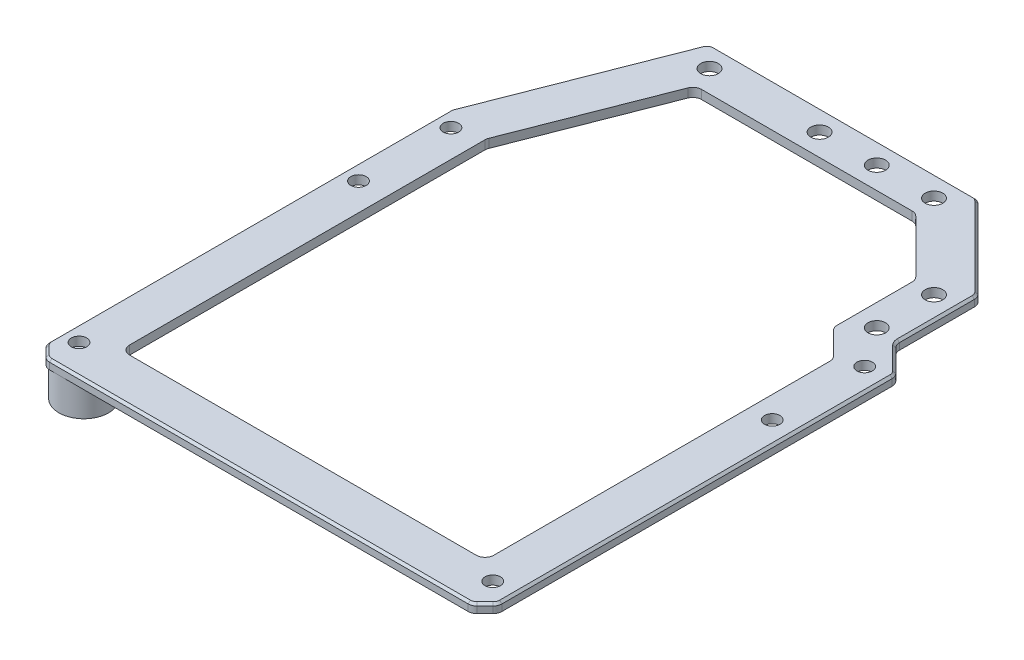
SolidWorks part; units mm, degrees
ref_plane "Спереди" through (0, 0, 0) normal (0, 0, 1) x (1, 0, 0)
ref_plane "Сверху" through (0, 0, 0) normal (0, 1, 0) x (1, 0, 0)
ref_plane "Справа" through (0, 0, 0) normal (1, 0, 0) x (0, 0, -1)
sketch "Эскиз1" plane through (0, 0, 0) normal (0, 1, 0) x (1, 0, 0)
  line L1 (-54, 0) -> (54, 0)
  line L2 (-54, 0) -> (-54, 92)
  line L3 (-54, 92) -> (54, 92)
  line L4 (54, 0) -> (54, 92)
  circle A0 centre (-50.25, 88.25) radius 1.75
  circle A1 centre (-50.25, 67.25) radius 1.75
  circle A2 centre (-50.25, 3.75) radius 1.75
  circle A3 centre (43.75, 3.75) radius 1.75
  circle A4 centre (43.75, 67.25) radius 1.75
  circle A5 centre (43.75, 88.25) radius 1.75
  point P0 (0, 0)
  dimension "D1" = 3.5
  dimension "D2" = 24.75
  dimension "D3" = 3.75
  dimension "D4" = 3.75
  dimension "D5" = 84.5
  dimension "D6" = 3.75
  dimension "D7" = 94
  dimension "D8" = 10.25
extrude "Бобышка-Вытянуть1" add sketch "Эскиз1" along normal blind 2
sketch "Эскиз2" plane through (0, 0, 0) normal (0, 1, 0) x (1, 0, 0)
  line L0 (37.5, 58.6841) -> (37.5, 145.1894) construction
  line L1 (37.5, 129.25) -> (14.1487, 129.25) construction
  line L2 (23.5, 134.25) -> (-37.5, 134.25)
  line L3 (-37.5, 134.25) -> (-54, 92)
  line L4 (-54, 92) -> (-54, 0)
  line L5 (-54, 0) -> (-51, -3)
  line L6 (-51, -3) -> (45.75, -3)
  line L7 (45.75, -3) -> (48.75, 0)
  line L8 (48.75, 0) -> (48.75, 90.3211)
  line L9 (48.75, 90.3211) -> (42.5, 96.5711)
  line L10 (42.5, 96.5711) -> (42.5, 115.25)
  line L11 (42.5, 115.25) -> (23.5, 134.25)
  line L12 (-32.5, 129.25) -> (-38.0503, 129.25) construction
  line L13 (-54, 0) -> (54, 0) construction
  line L14 (32.5, 111.1079) -> (19.3579, 124.25)
  line L15 (19.3579, 124.25) -> (-30.6698, 124.25)
  line L16 (-30.6698, 124.25) -> (-44, 90.1166)
  line L17 (-44, 90.1166) -> (-44, 7)
  line L18 (-44, 7) -> (-44, 7)
  line L19 (-44, 7) -> (38.75, 7)
  line L20 (38.75, 7) -> (38.75, 7)
  line L21 (38.75, 7) -> (38.75, 86.1789)
  line L22 (38.75, 86.1789) -> (32.5, 92.4289)
  line L23 (32.5, 92.4289) -> (32.5, 111.1079)
  circle A0 centre (43.75, 88.25) radius 1.75 construction
  circle A1 centre (37.5, 97.25) radius 2
  circle A2 centre (37.5, 110.25) radius 2
  circle A3 centre (18.5, 129.25) radius 2
  circle A4 centre (5.5, 129.25) radius 2
  circle A5 centre (-7.5, 129.25) radius 2
  circle A6 centre (-32.5, 129.25) radius 2
  circle A7 centre (43.75, 67.25) radius 1.75 construction
  circle A8 centre (43.75, 3.75) radius 1.75 construction
  circle A9 centre (-50.25, 3.75) radius 1.75 construction
  circle A10 centre (-50.25, 67.25) radius 1.75 construction
  circle A11 centre (-50.25, 88.25) radius 1.75 construction
  circle A12 centre (43.75, 88.25) radius 1.75
  circle A13 centre (43.75, 67.25) radius 1.75
  circle A14 centre (43.75, 3.75) radius 1.75
  circle A15 centre (-50.25, 3.75) radius 1.75
  circle A16 centre (-50.25, 67.25) radius 1.75
  circle A17 centre (-50.25, 88.25) radius 1.75
  point P32 (-37.5, 129.25)
  point P37 (23.5, 129.25)
  dimension "D1" = 6.25
  dimension "D2" = 4
  dimension "D3" = 9
  dimension "D9" = 25
  dimension "D13" = 5
  dimension "D14" = 5
  dimension "D4" = 13
  dimension "D5" = 19
  dimension "D6" = 19
  dimension "D7" = 13
  dimension "D8" = 13
  dimension "D10" = 5
  dimension "D11" = 135
  dimension "D12" = 5
  dimension "D15" = 135
  dimension "D16" = 135
  dimension "D17" = 5
  dimension "D18" = 3
  dimension "D19" = 5
  dimension "D20" = 10
sketch "Эскиз3" plane through (0, 2, 0) normal (0, 1, 0) x (1, 0, 0)
  line L0 (-43.2645, 92) -> (-44, 90.1166)
  line L1 (-30.6698, 124.25) -> (-44, 90.1166) construction
  line L2 (54, 92) -> (-54, 92) construction
  line L3 (-44, 90.1166) -> (-44, 7)
  line L4 (-44, 7) -> (38.75, 7)
  line L5 (38.75, 7) -> (38.75, 86.1789)
  line L6 (38.75, 86.1789) -> (32.9289, 92)
  line L7 (38.75, 86.1789) -> (32.5, 92.4289) construction
  line L8 (32.9289, 92) -> (-43.2645, 92)
  line L9 (47.0711, 92) -> (48.75, 90.3211)
  line L10 (48.75, 90.3211) -> (42.5, 96.5711) construction
  line L11 (48.75, 90.3211) -> (48.75, 0)
  line L12 (48.75, 0) -> (54, 0)
  line L13 (54, 0) -> (54, 92)
  line L14 (54, 0) -> (54, 92) construction
  line L15 (54, 92) -> (47.0711, 92)
extrude "Вырез-Вытянуть1" cut sketch "Эскиз3" against normal through all
extrude "Бобышка-Вытянуть2" add sketch "Эскиз2" along normal blind 2
fillet "Скругление1" radius 2 18 edges at (23.5, 1, -134.25) (42.5, 1, -115.25) (42.5, 1, -96.5711) (48.75, 1, -90.3211) (-37.5, 1, -134.25) (-54, 1, -92) (-54, 1, 0) (-51, 1, 3) (45.75, 1, 3) (48.75, 1, 0) (38.75, 1, -7) (-44, 1, -7) (38.75, 1, -86.1789) (32.5, 1, -92.4289) (32.5, 1, -111.1079) (19.3579, 1, -124.25) (-44, 1, -90.1166) (-30.6698, 1, -124.25)
chamfer "Фаска1" distance 0.5 angle 45 20 edges at (45.625, 2, -93.4461) (42.6522, 2, -96.6341) (48.5978, 2, -90.258) (42.5, 2, -105.9105) (48.75, 2, -45.1605) (42.3478, 2, -115.1869) (48.5978, 2, -0.0631) (33, 2, -124.75) (47.25, 2, 1.5) (23.4369, 2, -134.0978) (45.6869, 2, 2.8478) (-6.7312, 2, -134.25) (-2.625, 2, 3) (-37.262, 2, -133.9015) (-50.9369, 2, 2.8478) (-45.93, 2, -112.6642) (-52.5, 2, 1.5) (-53.9654, 2, -91.9935) (-53.8478, 2, -0.0631) (-54, 2, -46.2259)
sketch "Эскиз5" plane through (0, 0, 0) normal (0, -1, 0) x (1, 0, 0)
  line L0 (-50.1716, 3) -> (44.9216, 3) construction
  circle A0 centre (-48.0613, -2.6494) radius 5.6494
extrude "Бобышка-Вытянуть3" add sketch "Эскиз5" along normal blind 7.4
